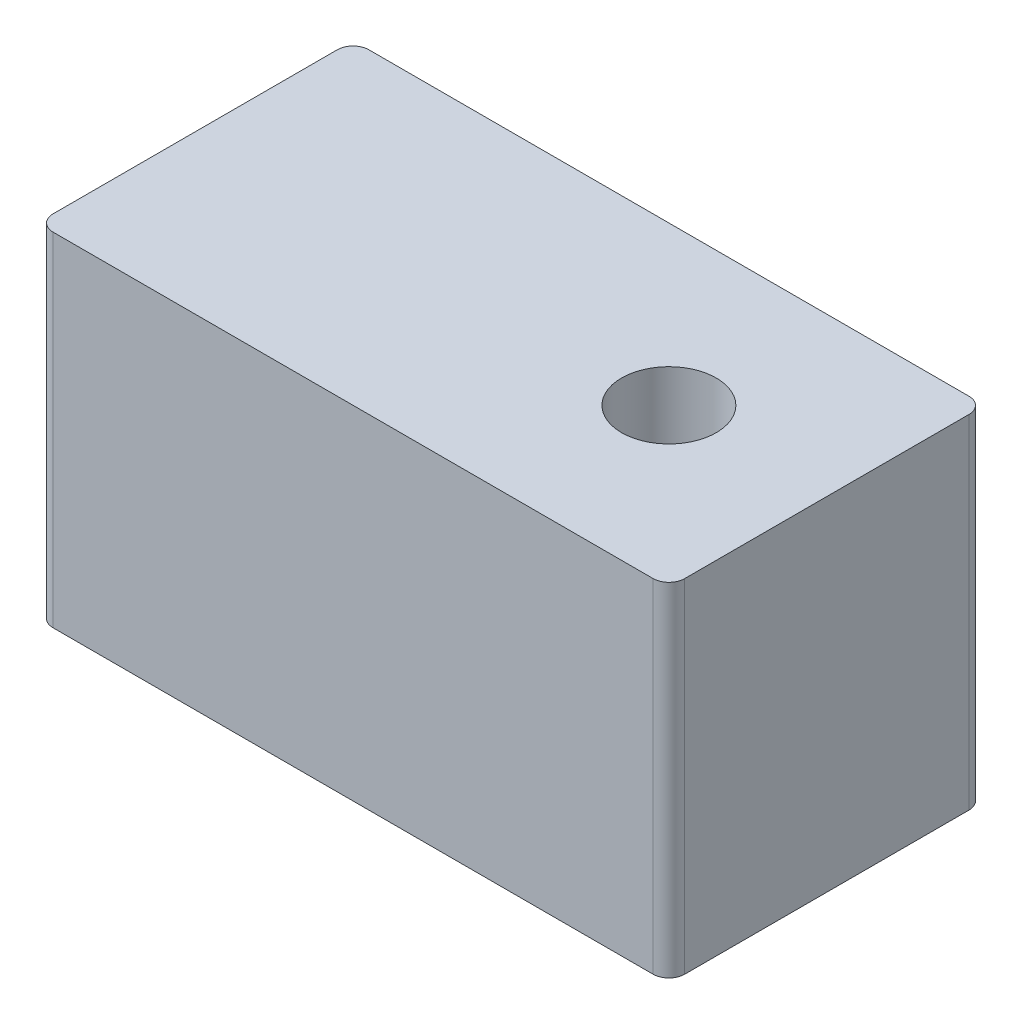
SolidWorks part; units mm, degrees
ref_plane "Přední" through (0, 0, 0) normal (0, 0, 1) x (1, 0, 0)
ref_plane "Horní" through (0, 0, 0) normal (0, 1, 0) x (1, 0, 0)
ref_plane "Pravá" through (0, 0, 0) normal (1, 0, 0) x (0, 0, -1)
sketch "Skica1" plane through (0, 0, 0) normal (0, 1, 0) x (1, 0, 0)
  line L0 (0, 21.8461) -> (0, -13.7975) construction
  line L1 (-25.2955, 0) -> (24.7206, 0) construction
  line L2 (-19, 10) -> (19, 10)
  line L3 (20, 9) -> (20, -9)
  line L4 (-20, 9) -> (-20, -9)
  line L5 (-19, -10) -> (19, -10)
  arc A0 (19, 10) -> (20, 9) centre (19, 9) cw
  arc A1 (-19, 10) -> (-20, 9) centre (-19, 9) ccw
  arc A2 (20, -9) -> (19, -10) centre (19, -9) cw
  arc A3 (-20, -9) -> (-19, -10) centre (-19, -9) ccw
  point P8 (0, 10)
  dimension "D1" = 1
  dimension "D2" = 40
  dimension "D3" = 20
extrude "Základ-Protažení" add sketch "Skica1" along normal blind 21.7
sketch "Skica2" plane through (0, 21.7, 0) normal (0, 1, 0) x (-1, 0, 0)
  line L0 (0, 0) -> (17.4601, 0) construction
  line L2 (-20, 9) -> (-20, -9) construction
  circle A0 centre (-10, 0) radius 3
  dimension "D1" = 10
  dimension "D2" = 6
extrude "Odebrat vysunutím1" cut sketch "Skica2" against normal blind 10
